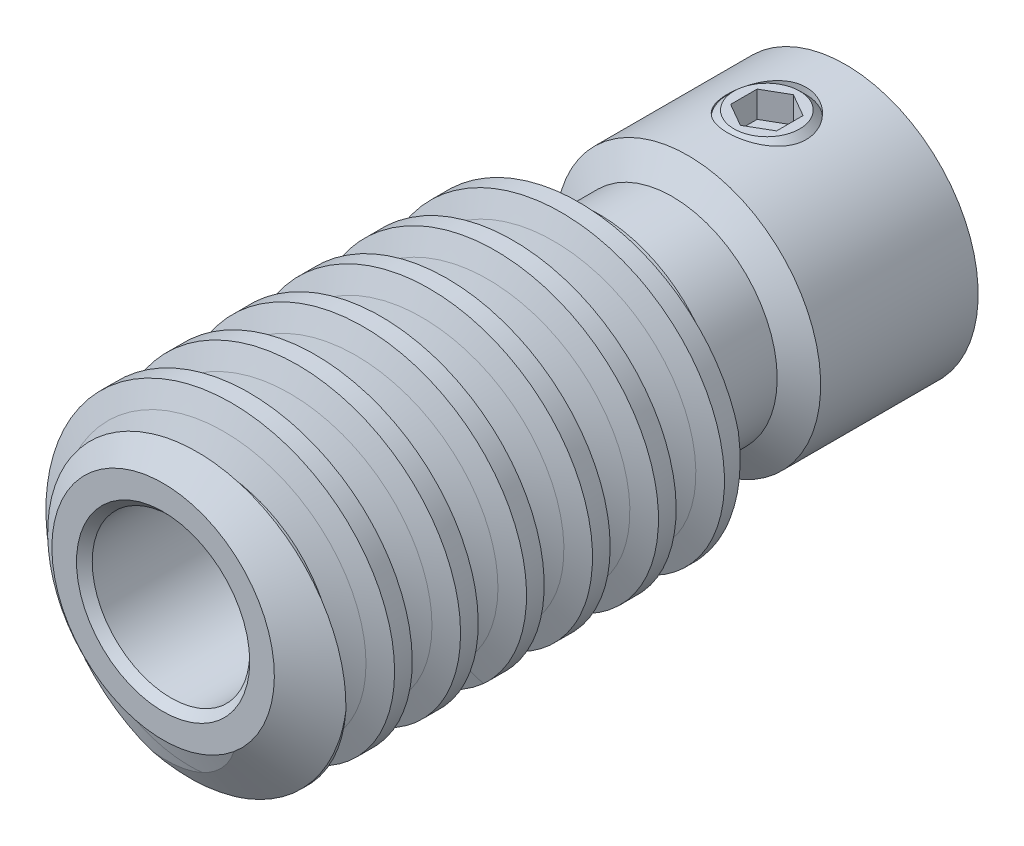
SolidWorks part; units mm, degrees
ref_plane "Front Plane" through (0, 0, 0) normal (0, 0, 1) x (1, 0, 0)
ref_plane "Top Plane" through (0, 0, 0) normal (0, 1, 0) x (1, 0, 0)
ref_plane "Right Plane" through (0, 0, 0) normal (1, 0, 0) x (0, 0, -1)
imported_body "Imported1"
sketch "Sketch1" plane through (0, 0, -17.5) normal (0, 0, -1) x (-1, 0, 0)
  circle A0 centre (0, 0) radius 3
  dimension "D1" = 6
extrude "Extrude1" cut sketch "Sketch1" against normal through all
